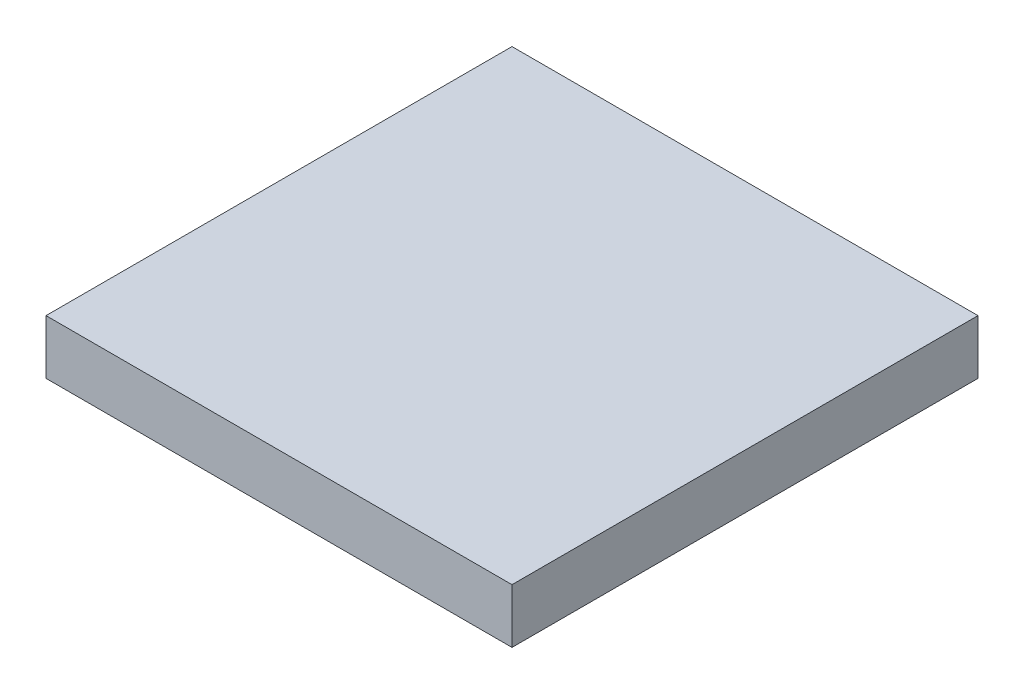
SolidWorks part; units mm, degrees
ref_plane "Plan de face" through (0, 0, 0) normal (0, 0, 1) x (1, 0, 0)
ref_plane "Plan de dessus" through (0, 0, 0) normal (0, 1, 0) x (1, 0, 0)
ref_plane "Plan de droite" through (0, 0, 0) normal (1, 0, 0) x (0, 0, -1)
sketch "Esquisse1" plane through (0, 0, 0) normal (0, 1, 0) x (1, 0, 0)
  line L1 (0, 0) -> (60, 0)
  line L2 (0, 0) -> (0, 60)
  line L3 (0, 60) -> (60, 60)
  line L4 (60, 0) -> (60, 60)
  dimension "D1" = 60
  dimension "D2" = 60
extrude "Extrusion1" add sketch "Esquisse1" along normal blind 7
